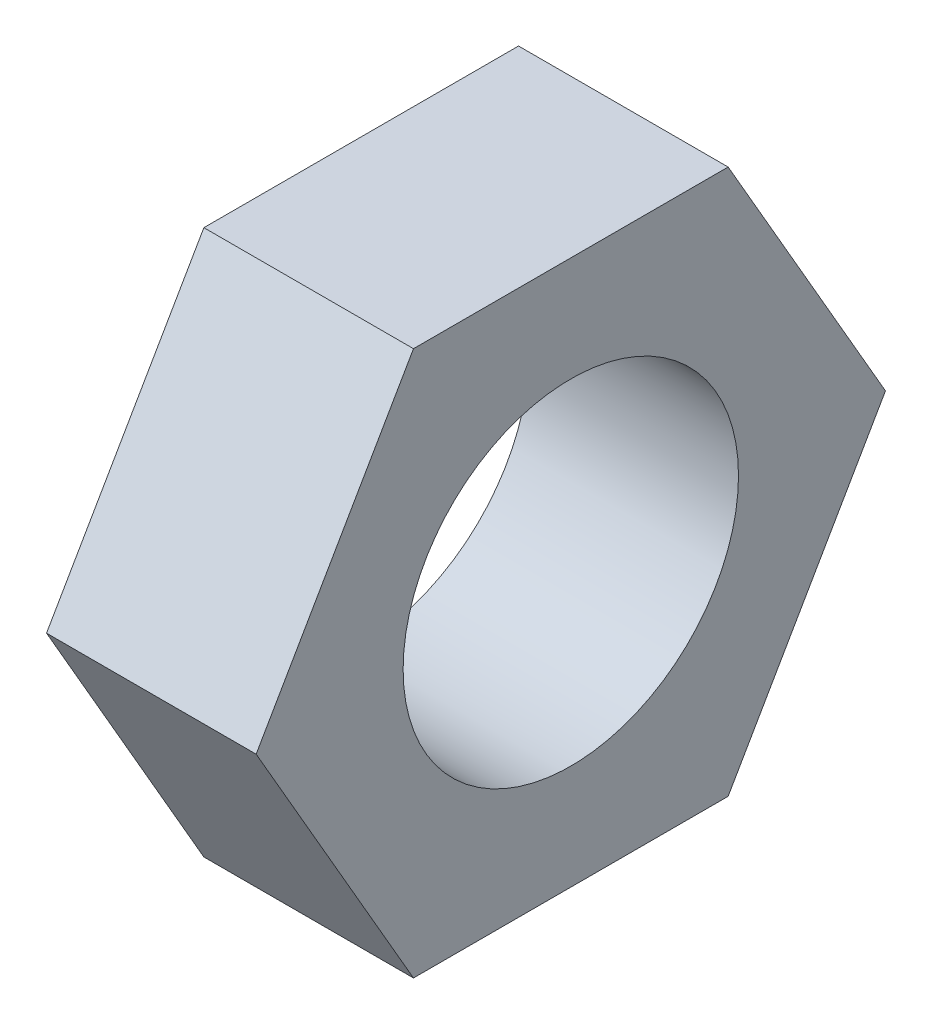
SolidWorks part; units mm, degrees
ref_plane "Front Plane" through (0, 0, 0) normal (0, 0, 1) x (1, 0, 0)
ref_plane "Top Plane" through (0, 0, 0) normal (0, 1, 0) x (1, 0, 0)
ref_plane "Right Plane" through (0, 0, 0) normal (1, 0, 0) x (0, 0, -1)
sketch "Sketch1" plane through (0, 0, 0) normal (1, 0, 0) x (0, 0, -1)
  line L1 (7.5056, 0) -> (3.7528, 6.5)
  line L2 (3.7528, 6.5) -> (-3.7528, 6.5)
  line L3 (-3.7528, 6.5) -> (-7.5056, 0)
  line L4 (-7.5056, 0) -> (-3.7528, -6.5)
  line L5 (-3.7528, -6.5) -> (3.7528, -6.5)
  line L6 (3.7528, -6.5) -> (7.5056, 0)
  circle A0 centre (0, 0) radius 4
  circle A1 centre (0, 0) radius 6.5 construction
  dimension "D1" = 8
  dimension "D2" = 13
extrude "Extrude1" add sketch "Sketch1" along normal blind 5
